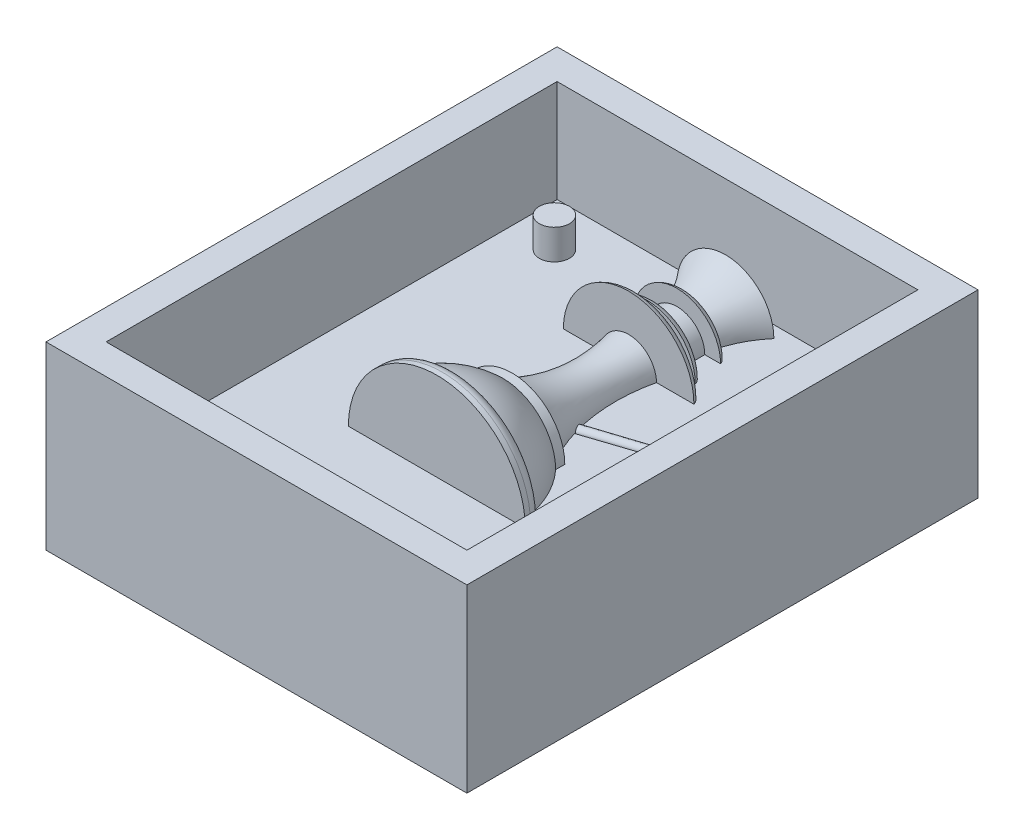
SolidWorks part; units mm, degrees
ref_plane "Front" through (0, 0, 0) normal (0, 0, 1) x (1, 0, 0)
ref_plane "Top" through (0, 0, 0) normal (0, 1, 0) x (1, 0, 0)
ref_plane "Right" through (0, 0, 0) normal (1, 0, 0) x (0, 0, -1)
sketch "Sketch1" plane through (0, 0, 0) normal (0, 1, 0) x (1, 0, 0)
  line L1 (-35, 42.5) -> (35, 42.5)
  line L2 (-35, 42.5) -> (-35, -42.5)
  line L3 (-35, -42.5) -> (35, -42.5)
  line L4 (35, 42.5) -> (35, -42.5)
  line L5 (-35, 42.5) -> (35, -42.5) construction
  line L6 (-35, -42.5) -> (35, 42.5) construction
  point P0 (0, 0)
  dimension "D1" = 70
  dimension "D2" = 85
extrude "Boss-Extrude1" add sketch "Sketch1" along normal blind 30
sketch "Sketch2" plane through (0, 30, 0) normal (0, 1, 0) x (1, 0, 0)
  line L4 (0, -37.5) -> (0, -62.5) construction
  line L8 (30, -37.5) -> (30, 37.5)
  line L9 (30, 37.5) -> (-30, 37.5)
  line L10 (-30, 37.5) -> (-30, -37.5)
  line L11 (-30, -37.5) -> (30, -37.5)
  line L12 (30, -37.5) -> (30, 37.5)
  line L13 (30, 37.5) -> (-30, 37.5)
  line L14 (-30, 37.5) -> (-30, -37.5)
  line L15 (-30, -37.5) -> (30, -37.5)
  dimension "D1" = 5
extrude "Cut-Extrude1" cut sketch "Sketch2" against normal blind 17
sketch "Sketch4" plane through (0, 13, 0) normal (0, 1, 0) x (1, 0, 0)
  line L0 (0, 42.5) -> (0, -42.5) construction
  line L1 (35, 42.5) -> (-35, 42.5) construction
  line L2 (-35, -42.5) -> (35, -42.5) construction
  line L3 (0, 37.5) -> (0, -12.5)
  line L4 (30, 37.5) -> (-30, 37.5) construction
  line L5 (0, 37.5) -> (1.76, 37.5)
  line L6 (1.76, 37.5) -> (1.76, 35.5)
  line L8 (4.6253, 28.7782) -> (7.2453, 28.7782)
  line L9 (7.2453, 28.7782) -> (7.2453, 27.4382)
  line L10 (7.2453, 27.4382) -> (4.6253, 27.4382)
  line L11 (4.6253, 27.4382) -> (4.6253, 23.8582)
  line L12 (4.6253, 23.8582) -> (8.0553, 23.8582)
  line L13 (8.0553, 23.8582) -> (8.0553, 22.4282)
  line L17 (10.8553, 20.8282) -> (10.8553, 19.3982)
  line L32 (8.0553, 22.4282) -> (4.6253, 22.4282)
  line L34 (4.6253, 20.8282) -> (10.8553, 20.8282)
  line L35 (10.8553, 19.3982) -> (4.6253, 19.3982)
  line L43 (14.7125, -12.5) -> (0, -12.5)
  line L46 (4.6253, 22.4282) -> (4.6253, 20.8282)
  line L47 (7.3563, 0) -> (8.7792, 0)
  line L48 (8.7792, 0) -> (8.7792, -1.5241)
  line L49 (14.7125, -12.5) -> (14.7125, -9.6367)
  line L50 (14.7125, -9.6367) -> (13.0634, -9.6367)
  line L52 (1.76, 35.5) -> (8.0553, 35.5)
  arc A1 (4.6253, 19.3982) -> (7.3563, 0) centre (31.5891, 13.3029) ccw
  arc A4 (8.7792, -1.5241) -> (13.0634, -9.6367) centre (-4.1307, -13.5292) cw
  arc A6 (8.0553, 35.5) -> (4.6253, 28.7782) centre (20.2085, 25.0624) ccw
  dimension "D1" = 50
  dimension "D2" = 1.76
  dimension "D3" = 2
  dimension "D6" = 2.62
  dimension "D7" = 1.34
  dimension "D8" = 2.62
  dimension "D9" = 3.58
  dimension "D10" = 3.43
  dimension "D12" = 1.43
  dimension "D16" = 1.43
revolve "Revolve2" add sketch "Sketch4" angle 360 about L0
fillet "Fillet1" radius 2 1 edges at (0, 27.7125, 9.6367)
fillet "Fillet2" radius 2 3 edges at (0, 23.8553, -20.8282) (0, 21.0553, -23.8582) (0, 20.2453, -28.7782)
sketch "Sketch5" plane through (0, 13, 0) normal (0, 1, 0) x (1, 0, 0)
  line L0 (4.9318, 5.9828) -> (30, 14.1967) construction
  line L1 (30, -37.5) -> (30, 37.5) construction
  line L6 (4.9318, 5.9828) -> (5.2389, 5.2828)
  line L7 (5.2389, 5.2828) -> (30.3275, 13.578)
  line L8 (30.3275, 13.578) -> (30, 14.1967)
  line L9 (4.9318, 5.9828) -> (30, 14.1967)
  arc A0 (4.6253, 19.3982) -> (7.3563, 0) centre (31.5891, 13.3029) ccw construction
  dimension "D1" = 0.7
  dimension "D2" = 0.7
revolve "Revolve3" add sketch "Sketch5" angle 360 about L0
sketch "Sketch6" plane through (0, 13, 0) normal (0, 1, 0) x (1, 0, 0)
  line L0 (-23, 42.5) -> (-23, -42.5) construction
  line L1 (35, 42.5) -> (-35, 42.5) construction
  line L2 (-35, -42.5) -> (35, -42.5) construction
  line L3 (23, 42.5) -> (23, -42.5) construction
  line L4 (30, 37.5) -> (-30, 37.5) construction
  line L5 (-30, -37.5) -> (30, -37.5) construction
  line L6 (30, -37.5) -> (30, 13.4697) construction
  line L7 (-30, 37.5) -> (-30, -37.5) construction
  circle A0 centre (-23, 30.0514) radius 2.5
  circle A1 centre (23, -30.5) radius 2.5
  dimension "D1" = 5
  dimension "D2" = 5
  dimension "D3" = 7.4486
  dimension "D4" = 7
  dimension "D5" = 7
  dimension "D6" = 7
extrude "Boss-Extrude2" add sketch "Sketch6" along normal blind 5
